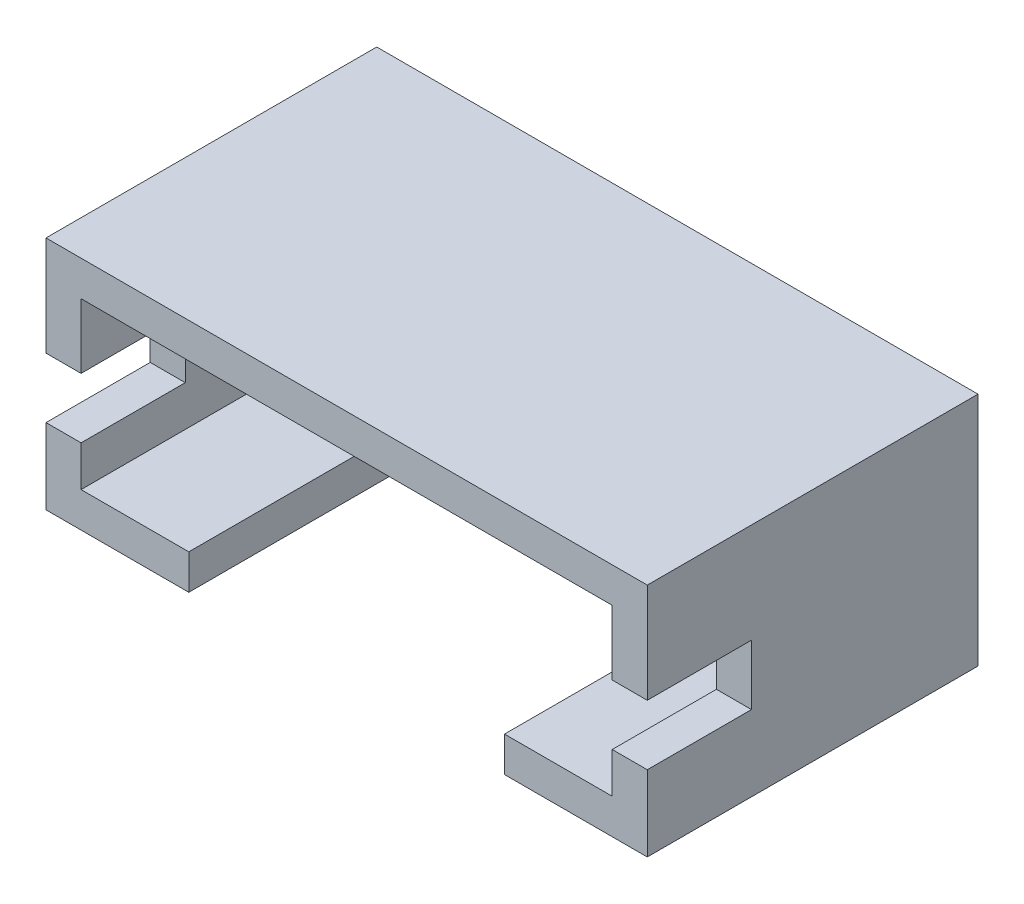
SolidWorks part; units mm, degrees
ref_plane "Face" through (0, 0, 0) normal (0, 0, 1) x (1, 0, 0)
ref_plane "Dessus" through (0, 0, 0) normal (0, 1, 0) x (1, 0, 0)
ref_plane "Droite" through (0, 0, 0) normal (1, 0, 0) x (0, 0, -1)
sketch "Esquisse1" plane through (0, 0, 0) normal (0, 0, 1) x (1, 0, 0)
  line L1 (22.2272, 0) -> (34.2272, 0)
  line L2 (22.2272, 0) -> (22.2272, 4.7)
  line L3 (22.2272, 4.7) -> (34.2272, 4.7)
  line L4 (34.2272, 0) -> (34.2272, 4.7)
  dimension "D1" = 4.7
  dimension "D2" = 12
extrude "Extrusion1" add sketch "Esquisse1" along normal blind 6.6
shell "Coque1" thickness 0.7
sketch "Esquisse2" plane through (34.2272, 0, 0) normal (1, 0, 0) x (0, 0, -1)
  line L0 (-6.6, 0) -> (-6.6, 4.7) construction
  line L1 (-6.6, 1.5086) -> (-4.5204, 1.5086)
  line L2 (-6.6, 1.5086) -> (-6.6, 2.7086)
  line L3 (-6.6, 2.7086) -> (-4.5204, 2.7086)
  line L4 (-4.5204, 1.5086) -> (-4.5204, 2.7086)
  line L5 (0, 2.35) -> (-5.6635, 2.35) construction
  line L6 (0, 0) -> (0, 4.7) construction
  dimension "D1" = 1.2
  dimension "D2" = 2.0796
extrude "Enlèv. mat.-Extru.1" cut sketch "Esquisse2" against normal through all
sketch "Esquisse3" plane through (0, 0, 0) normal (0, -1, 0) x (1, 0, 0)
  line L0 (22.2272, 6.6) -> (34.2272, 6.6) construction
  line L1 (25.0772, 6.6) -> (31.3772, 6.6)
  line L2 (25.0772, 6.6) -> (25.0772, 1.1619)
  line L3 (25.0772, 1.1619) -> (31.3772, 1.1619)
  line L4 (31.3772, 6.6) -> (31.3772, 1.1619)
  line L5 (28.2272, 0) -> (28.2272, 4.8072) construction
  line L6 (22.2272, 0) -> (34.2272, 0) construction
  point P6 (28.2272, 6.6)
  dimension "D1" = 6.3
extrude "Enlèv. mat.-Extru.2" cut sketch "Esquisse3" against normal up to next
sketch "Esquisse4" plane through (0, 0, 0.7) normal (0, 0, 1) x (1, 0, 0)
  line L0 (22.9272, 2.35) -> (34.921, 2.35) construction
  line L1 (22.9272, 4) -> (22.9272, 0.7) construction
  line L2 (28.2272, 4) -> (28.2272, 1.339) construction
  line L3 (33.5272, 4) -> (22.9272, 4) construction
  circle A0 centre (28.2272, 2.35) radius 0.3029
  circle A1 centre (30.2426, 2.35) radius 0.3029
  circle A2 centre (32.258, 2.35) radius 0.3029
  circle A3 centre (26.2426, 2.35) radius 0.3029
  circle A4 centre (24.258, 2.35) radius 0.3029
  dimension "D1" = 8
extrude "Extrusion2" add sketch "Esquisse4" along normal blind 3 and the other way blind 2
